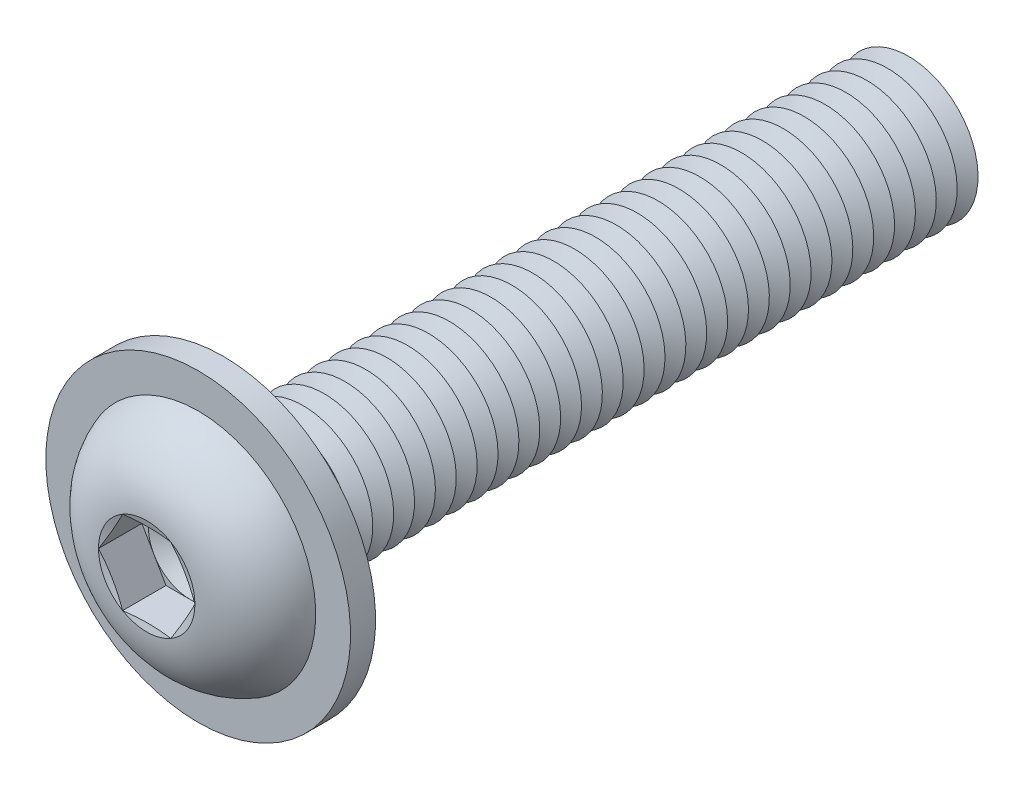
SolidWorks part; units mm, degrees
ref_plane "Front Plane" through (0, 0, 0) normal (0, 0, 1) x (1, 0, 0)
ref_plane "Top Plane" through (0, 0, 0) normal (0, 1, 0) x (1, 0, 0)
ref_plane "Right Plane" through (0, 0, 0) normal (1, 0, 0) x (0, 0, -1)
sketch "Sketch1" plane through (0, 0, 0) normal (1, 0, 0) x (0, 0, -1)
  line L0 (0, 5) -> (0, 8.75)
  line L3 (0, 5) -> (50, 5)
  line L4 (50, 5) -> (50, 0)
  line L5 (50, 0) -> (-5.5, 0) construction
  line L6 (-5.5, 0) -> (50, 0)
  line L7 (-5.5, 3.4641) -> (-5.5, 1.732) construction
  line L8 (-5.5, 1.732) -> (-5.5, 0)
  line L9 (-5.5, 3.4641) -> (-5.0359, 1.732)
  line L10 (-5.0359, 1.732) -> (-5.5, 1.732)
  line L11 (50, 0) -> (22.7481, 0) construction
  line L12 (0, 8.75) -> (-5.5, 8.75) construction
  arc A1 (0, 8.75) -> (-5.5, 3.4641) centre (0, 3.2457) ccw
  point P8 (50, 2.5)
  dimension "D1" = 17.5
  dimension "D2" = 10
  dimension "D3" = 5.5
  dimension "D4" = 6.9282
  dimension "D5" = 50
  dimension "D6" = 15
revolve "Revolve1" add sketch "Sketch1" angle 360 about L5
fillet "Fillet1" radius 0.75 1 edges at (0, 5, 0)
sketch "Sketch2" plane through (0, 0, 0) normal (1, 0, 0) x (0, 0, -1)
  line L0 (49.25, 5) -> (50.75, 5)
  line L1 (50, 5) -> (0.75, 5) construction
  line L2 (50.75, 5) -> (50, 3.701)
  line L3 (50, -5) -> (50, 5) construction
  line L4 (50, 3.701) -> (49.25, 5)
  dimension "D1" = 1.5
revolve "Cut-Revolve1" cut sketch "Sketch2" angle 360 about axis through (0, 0, -50) along (0, 0, -1)
pattern_linear "LPattern1" count 33 spacing 1.5 along (0, 0, 1) of "Cut-Revolve1"
sketch "Sketch3" plane through (0, 0, 5.5) normal (0, 0, 1) x (1, 0, 0)
  line L7 (1.732, 3) -> (-1.7321, 3)
  line L8 (-1.7321, 3) -> (-3.4641, 0)
  line L9 (-3.4641, 0) -> (-1.732, -3)
  line L10 (-1.732, -3) -> (1.732, -3)
  line L11 (1.732, -3) -> (3.4641, 0)
  line L12 (3.4641, 0) -> (1.732, 3)
  circle A0 centre (0, 0) radius 3 construction
  circle A3 centre (0, 0) radius 3.4641 construction
extrude "Cut-Extrude1" cut sketch "Sketch3" against normal blind 3.12
sketch "Sketch4" plane through (0, 0, 2.38) normal (0, 0, 1) x (1, 0, 0)
  line L1 (1.732, 3) -> (-1.7321, 3) construction
  circle A0 centre (0, 0) radius 3
extrude "Cut-Extrude2" cut sketch "Sketch4" against normal through all draft 60
sketch "Sketch5" plane through (0, 0, 0) normal (0, 0, -1) x (-1, 0, 0)
  circle A0 centre (0, 0) radius 10.95
  circle A1 centre (0, 0) radius 5.75
  circle A2 centre (0, 0) radius 5.75 construction
  dimension "D1" = 21.9
extrude "Boss-Extrude1" add sketch "Sketch5" against normal blind 1.8
